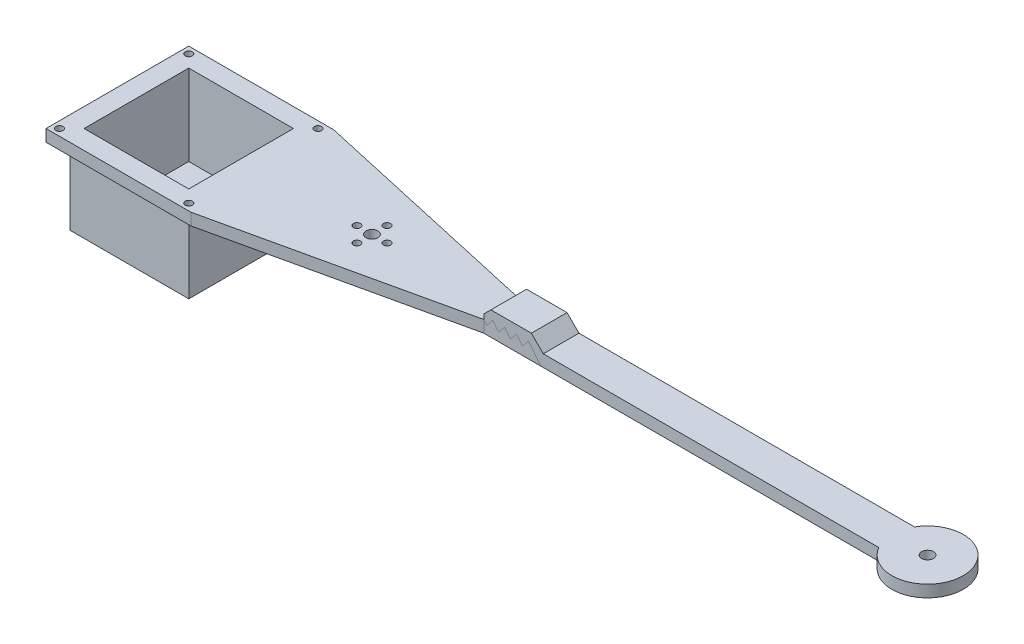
SolidWorks part; units mm, degrees
ref_plane "Front Plane" through (0, 0, 0) normal (0, 0, 1) x (1, 0, 0)
ref_plane "Top Plane" through (0, 0, 0) normal (0, 1, 0) x (1, 0, 0)
ref_plane "Right Plane" through (0, 0, 0) normal (1, 0, 0) x (0, 0, -1)
sketch "Sketch2" plane through (0, 0, 0) normal (0, 1, 0) x (1, 0, 0)
  line L1 (0, 0) -> (50, 0)
  line L2 (0, 0) -> (0, 50)
  line L3 (0, 50) -> (50, 50)
  line L4 (50, 0) -> (50, 50)
  dimension "D1" = 50
  dimension "D2" = 50
extrude "Boss-Extrude1" add sketch "Sketch2" along normal blind 37
sketch "Sketch3" plane through (0, 37, 0) normal (0, 1, 0) x (1, 0, 0)
  line L8 (3, 47) -> (3, 3)
  line L9 (3, 3) -> (47, 3)
  line L10 (47, 3) -> (47, 47)
  line L11 (47, 47) -> (3, 47)
  line L12 (3, 47) -> (3, 3)
  line L13 (3, 3) -> (47, 3)
  line L14 (47, 3) -> (47, 47)
  line L15 (47, 47) -> (3, 47)
  dimension "D1" = 3
extrude "Cut-Extrude1" cut sketch "Sketch3" against normal offset from surface (34 mm away) 3
sketch "Sketch10" plane through (0, 37, 0) normal (0, 1, 0) x (1, 0, 0)
  line L8 (-5, 55) -> (-5, -5)
  line L9 (-5, -5) -> (55, -5)
  line L10 (55, -5) -> (55, 55)
  line L11 (55, 55) -> (-5, 55)
  line L12 (-5, 55) -> (-5, -5)
  line L13 (-5, -5) -> (55, -5)
  line L14 (55, -5) -> (55, 55)
  line L15 (55, 55) -> (-5, 55)
  line L26 (3, 3) -> (47, 3)
  line L27 (47, 3) -> (47, 47)
  line L28 (3, 47) -> (3, 3)
  line L29 (47, 47) -> (3, 47)
  line L30 (3, 3) -> (47, 3)
  line L31 (47, 3) -> (47, 47)
  line L32 (3, 47) -> (3, 3)
  line L33 (47, 47) -> (3, 47)
  dimension "D1" = 5
  dimension "D2" = 0
extrude "Boss-Extrude4" add sketch "Sketch10" against normal blind 5
sketch "Sketch11" plane through (0, 37, 0) normal (0, 1, 0) x (1, 0, 0)
  line L0 (-5, 55) -> (-2.1716, 52.1716) construction
  line L1 (55, 55) -> (52.1716, 52.1716) construction
  line L2 (55, -5) -> (52.1716, -2.1716) construction
  line L3 (-5, -5) -> (-2.1716, -2.1716) construction
  line L4 (55, 55) -> (-5, 55) construction
  line L5 (-5, -5) -> (55, -5) construction
  line L6 (-5, 55) -> (-5, -5) construction
  circle A0 centre (-2.1716, 52.1716) radius 1.5
  circle A1 centre (52.1716, 52.1716) radius 1.5
  circle A2 centre (52.1716, -2.1716) radius 1.5
  circle A3 centre (-2.1716, -2.1716) radius 1.5
  dimension "D5" = 3
  dimension "D6" = 3
  dimension "D7" = 3
  dimension "D8" = 3
  dimension "D1" = 4
  dimension "D2" = 4
  dimension "D3" = 4
  dimension "D4" = 4
  dimension "D9" = 45
  dimension "D10" = 45
  dimension "D11" = 45
  dimension "D12" = 45
extrude "Cut-Extrude2" cut sketch "Sketch11" against normal up to next
sketch "Sketch12" plane through (0, 37, 0) normal (0, 1, 0) x (1, 0, 0)
  line L0 (47, 25) -> (102, 25) construction
  line L1 (47, 3) -> (47, 47) construction
  line L2 (55, 53.5657) -> (55, 55)
  line L7 (55, -5) -> (55, -3.5657)
  line L8 (55, 55) -> (55.9023, 55)
  line L9 (55, -5) -> (55.9023, -5)
  arc A0 (55.9023, -5) -> (55.9023, 55) centre (102, 25) ccw
  arc A1 (55, 53.5657) -> (55, -3.5657) centre (102, 25) ccw
  dimension "D1" = 55
extrude "Boss-Extrude5" add sketch "Sketch12" against normal blind 5
sketch "Sketch13" plane through (0, 37, 0) normal (0, 1, 0) x (1, 0, 0)
  circle A0 centre (102, 25) radius 6.35 construction
  circle A1 centre (102, 31.35) radius 1.5
  circle A2 centre (108.35, 25) radius 1.5
  circle A3 centre (102, 18.65) radius 1.5
  circle A4 centre (95.65, 25) radius 1.5
  circle A5 centre (102, 25) radius 2.5
  dimension "D1" = 12.7
  dimension "D2" = 3
  dimension "D3" = 3
  dimension "D4" = 3
  dimension "D5" = 5
  dimension "D6" = 3
extrude "Cut-Extrude3" cut sketch "Sketch13" against normal through all
sketch "Sketch16" plane through (0, 37, 0) normal (0, 1, 0) x (1, 0, 0)
  line L0 (102, 25) -> (145, 25) construction
  line L1 (145, 25) -> (335.5, 25) construction
  line L2 (335.5, 32.5) -> (335.5, 17.5)
  line L3 (335.5, 32.5) -> (156.4862, 32.5)
  line L4 (335.5, 17.5) -> (156.4862, 17.5)
  line L5 (156.4862, 17.5) -> (156.4862, 32.5)
  arc A0 (55.9023, -5) -> (55.9023, 55) centre (102, 25) ccw construction
  point P7 (335.5, 25)
  dimension "D1" = 43
  dimension "D2" = 190.5
  dimension "D3" = 15
extrude "Boss-Extrude7" add sketch "Sketch16" against normal blind 5
sketch "Sketch17" plane through (0, 37, 0) normal (0, 1, 0) x (1, 0, 0)
  line L0 (335.5, 17.5) -> (335.5, 32.5) construction
  circle A0 centre (335.5, 25) radius 15
  dimension "D1" = 30
extrude "Boss-Extrude8" add sketch "Sketch17" against normal blind 5
sketch "Sketch18" plane through (0, 37, 0) normal (0, 1, 0) x (1, 0, 0)
  circle A0 centre (335.5, 25) radius 2.5
  dimension "D1" = 5
extrude "Cut-Extrude5" cut sketch "Sketch18" against normal through all
sketch "Sketch19" plane through (0, 37, 0) normal (0, 1, 0) x (1, 0, 0)
  line L0 (55.9023, 55) -> (156.4862, 32.5)
  line L1 (156.4862, 32.5) -> (175.6422, 60.4316)
  line L2 (175.6422, 60.4316) -> (57.5856, 109.4536)
  line L3 (57.5856, 109.4536) -> (55.9023, 55)
  line L4 (55.9023, -5) -> (156.4862, 17.5)
  line L5 (156.4862, 17.5) -> (168.6653, -20.3536)
  line L6 (168.6653, -20.3536) -> (54.4643, -47.7104)
  line L7 (54.4643, -47.7104) -> (55.9023, -5)
extrude "Cut-Extrude6" cut sketch "Sketch19" against normal through all
sketch "Sketch20" plane through (0, 0, -17.5) normal (0, 0, 1) x (1, 0, 0)
  line L0 (156.4862, 37) -> (156.4862, 42)
  line L1 (156.4862, 37) -> (176.4862, 37)
  line L2 (156.4862, 37) -> (322.5096, 37) construction
  line L3 (176.4862, 37) -> (176.4862, 42)
  line L4 (176.4862, 42) -> (156.4862, 42)
  dimension "D1" = 5
  dimension "D2" = 20
extrude "Boss-Extrude9" add sketch "Sketch20" against normal up to vertex
sketch "Sketch22" plane through (0, 0, -17.5) normal (0, 0, 1) x (1, 0, 0)
  line L0 (156.4862, 37) -> (176.4862, 37) construction
  line L4 (171.4862, 37) -> (176.4862, 37) construction
  line L5 (176.4862, 37) -> (175.2362, 38.5612)
  line L6 (171.4862, 37) -> (176.4862, 37) construction
  line L7 (173.9862, 37) -> (175.2362, 38.5612)
  line L8 (173.9862, 37) -> (172.7362, 35.4388)
  line L9 (172.7362, 35.4388) -> (171.4862, 37)
  line L10 (167.7362, 35.4388) -> (166.4862, 37)
  line L11 (168.9862, 37) -> (167.7362, 35.4388)
  line L12 (168.9862, 37) -> (170.2362, 38.5612)
  line L13 (171.4862, 37) -> (170.2362, 38.5612)
  line L14 (162.7362, 35.4388) -> (161.4862, 37)
  line L15 (163.9862, 37) -> (162.7362, 35.4388)
  line L16 (163.9862, 37) -> (165.2362, 38.5612)
  line L17 (166.4862, 37) -> (165.2362, 38.5612)
  line L18 (157.7362, 35.4388) -> (156.4862, 37)
  line L19 (158.9862, 37) -> (157.7362, 35.4388)
  line L20 (158.9862, 37) -> (160.2362, 38.5612)
  line L21 (161.4862, 37) -> (160.2362, 38.5612)
  line L22 (176.4862, 37) -> (180.4894, 32)
  line L23 (156.4862, 32) -> (322.5096, 32) construction
  dimension "D1" = 2
  dimension "D2" = 2
  dimension "D3" = 2
  dimension "D4" = 2
  dimension "D5" = 5
  dimension "D6" = 4
chamfer "Chamfer2" distance 5 angle 45 3 edges at (176.4862, 37, -25) (176.4862, 39.5, -32.5) (176.4862, 39.5, -17.5)
chamfer "Chamfer3" distance 3 angle 45 1 edges at (156.4862, 42, -25)
split "Split1" trim tools "Sketch22" bodies to split 115 resulting bodies 117 118
